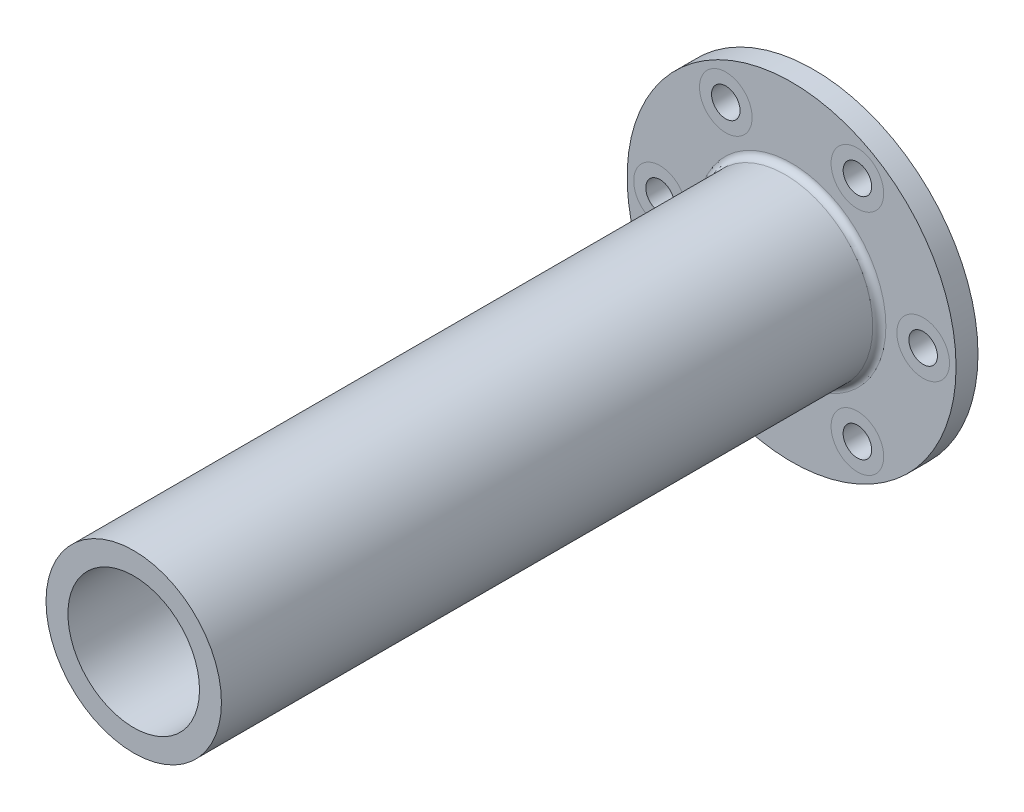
SolidWorks part; units mm, degrees
ref_plane "Front Plane" through (0, 0, 0) normal (0, 0, 1) x (1, 0, 0)
ref_plane "Top Plane" through (0, 0, 0) normal (0, 1, 0) x (1, 0, 0)
ref_plane "Right Plane" through (0, 0, 0) normal (1, 0, 0) x (0, 0, -1)
sketch "Sketch1" plane through (0, 0, 0) normal (0, 0, 1) x (1, 0, 0)
  circle A0 centre (0, 0) radius 75
  dimension "D1" = 150
extrude "Extrude1" add sketch "Sketch1" along normal blind 10
sketch "Sketch2" plane through (0, 0, 10) normal (0, 0, 1) x (1, 0, 0)
  circle A0 centre (0, 0) radius 40
  dimension "D1" = 80
extrude "Extrude2" add sketch "Sketch2" along normal blind 300
sketch "Sketch3" plane through (0, 0, 310) normal (0, 0, 1) x (1, 0, 0)
  circle A0 centre (0, 0) radius 30
  dimension "D1" = 60
extrude "Cut-Extrude1" cut sketch "Sketch3" against normal through all
fillet "Fillet1" radius 3 1 edges at (40, 0, 10)
sketch "Sketch4" plane through (0, 0, 0) normal (0, 0, -1) x (-1, 0, 0)
  line L0 (0, 0) -> (105.4094, 0) construction
  circle A0 centre (0, 0) radius 60 construction
  circle A2 centre (60, 0) radius 6.5
  dimension "D1" = 120
  dimension "D2" = 13
extrude "Cut-Extrude2" cut sketch "Sketch4" against normal through all
pattern_circular "CirPattern1" count 6 over 360 about axis through (0, 0, 0) along (0, 0, 1) of "Cut-Extrude2", "Cut-Extrude1"
sketch "Sketch5" plane through (0, 0, 10) normal (0, 0, 1) x (1, 0, 0)
  circle A0 centre (-30, -51.9615) radius 12
  circle A1 centre (-30, -51.9615) radius 6.5 construction
  dimension "D1" = 24
sketch "Sketch6" plane through (0, 0, 10) normal (0, 0, 1) x (1, 0, 0)
  circle A0 centre (30, -51.9615) radius 12
  circle A1 centre (30, -51.9615) radius 6.5 construction
  dimension "D1" = 24
sketch "Sketch7" plane through (0, 0, 10) normal (0, 0, 1) x (1, 0, 0)
  circle A0 centre (60, 0) radius 12
  circle A1 centre (60, 0) radius 6.5 construction
  dimension "D1" = 24
sketch "Sketch8" plane through (0, 0, 10) normal (0, 0, 1) x (1, 0, 0)
  circle A0 centre (30, 51.9615) radius 12
  circle A1 centre (30, 51.9615) radius 6.5 construction
  dimension "D1" = 24
sketch "Sketch9" plane through (0, 0, 10) normal (0, 0, 1) x (1, 0, 0)
  circle A0 centre (-30, 51.9615) radius 12
  circle A1 centre (-30, 51.9615) radius 6.5 construction
  dimension "D1" = 24
sketch "Sketch10" plane through (0, 0, 10) normal (0, 0, 1) x (1, 0, 0)
  circle A0 centre (-60, 0) radius 12
  circle A1 centre (-60, 0) radius 6.5 construction
  dimension "D1" = 24
